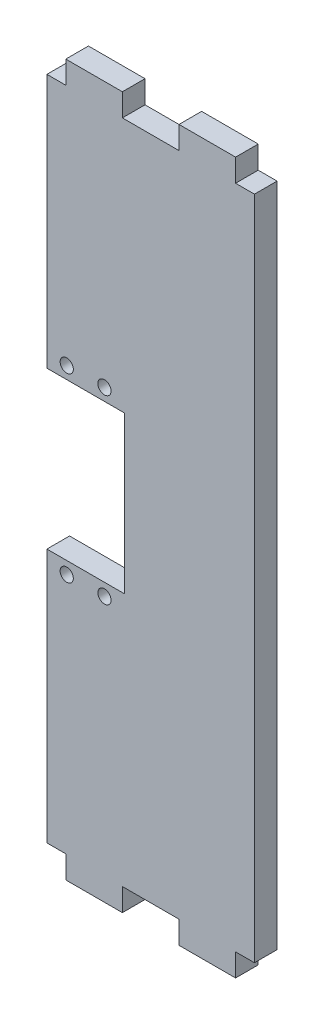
SolidWorks part; units mm, degrees
ref_plane "Alzado" through (0, 0, 0) normal (0, 0, 1) x (1, 0, 0)
ref_plane "Planta" through (0, 0, 0) normal (0, 1, 0) x (1, 0, 0)
ref_plane "Vista lateral" through (0, 0, 0) normal (1, 0, 0) x (0, 0, -1)
sketch "Croquis1" plane through (0, 0, 0) normal (0, 0, 1) x (1, 0, 0)
  line L1 (-27.5, -88.2) -> (27.5, -88.2)
  line L2 (-27.5, -88.2) -> (-27.5, 88.2)
  line L3 (-27.5, 88.2) -> (27.5, 88.2)
  line L4 (27.5, -88.2) -> (27.5, 88.2)
  line L5 (-27.5, -88.2) -> (27.5, 88.2) construction
  line L6 (-27.5, 88.2) -> (27.5, -88.2) construction
  point P0 (0, 0)
  dimension "D1" = 176.4
  dimension "D2" = 55
extrude "Saliente-Extruir1" add sketch "Croquis1" along normal blind 6
sketch "Croquis2" plane through (0, -88.2, 0) normal (0, -1, 0) x (1, 0, 0)
  line L0 (-27.5, 6) -> (27.5, 6) construction
  line L1 (-22.5, 6) -> (-7.5, 6)
  line L2 (-22.5, 6) -> (-22.5, 0)
  line L3 (-22.5, 0) -> (-7.5, 0)
  line L4 (-7.5, 6) -> (-7.5, 0)
  line L5 (-27.5, 0) -> (27.5, 0) construction
  line L7 (7.5, 6) -> (22.5, 6)
  line L8 (7.5, 6) -> (7.5, 0)
  line L9 (7.5, 0) -> (22.5, 0)
  line L10 (22.5, 6) -> (22.5, 0)
  dimension "D1" = 15
  dimension "D2" = 15
  dimension "D3" = 15
  dimension "D4" = 7.5
extrude "Saliente-Extruir2" add sketch "Croquis2" along normal blind 6 and the other way blind 182.4
sketch "Croquis3" plane through (0, 0, 6) normal (0, 0, 1) x (1, 0, 0)
  line L0 (-27.5, 88.2) -> (-27.5, -88.2) construction
  line L1 (-7, -20.75) -> (-27.5, -20.75)
  line L2 (-7, -20.75) -> (-7, 20.75)
  line L3 (-7, 20.75) -> (-27.5, 20.75)
  line L4 (-27.5, -20.75) -> (-27.5, 20.75)
  line L5 (-7, -20.75) -> (-27.5, 20.75) construction
  line L6 (-7, 20.75) -> (-27.5, -20.75) construction
  point P0 (0, 0)
  point P6 (0, 0)
  dimension "D1" = 41.5
  dimension "D2" = 20.5
extrude "Cortar-Extruir1" cut sketch "Croquis3" against normal blind 6
sketch "Croquis4" plane through (0, 0, 6) normal (0, 0, 1) x (1, 0, 0)
  line L0 (-12.586, 0) -> (-21.914, 0) construction
  line L1 (-17.25, -20.75) -> (-17.25, 20.75) construction
  line L3 (-27.5, -20.75) -> (-7, -20.75) construction
  line L4 (-7, 20.75) -> (-27.5, 20.75) construction
  circle A0 centre (-22.25, 24) radius 1.75
  circle A1 centre (-22.25, -24) radius 1.75
  circle A2 centre (-12.25, -24) radius 1.75
  circle A3 centre (-12.25, 24) radius 1.75
  point P15 (-17.25, -20.75)
  point P16 (0, 0)
  point P17 (0, 0)
  point P18 (0, 0)
  point P21 (-17.25, 0)
  point P22 (-17.25, 0)
  dimension "D3" = 3.5
  dimension "D1" = 24
  dimension "D2" = 5
extrude "Cortar-Extruir2" cut sketch "Croquis4" against normal up to next
